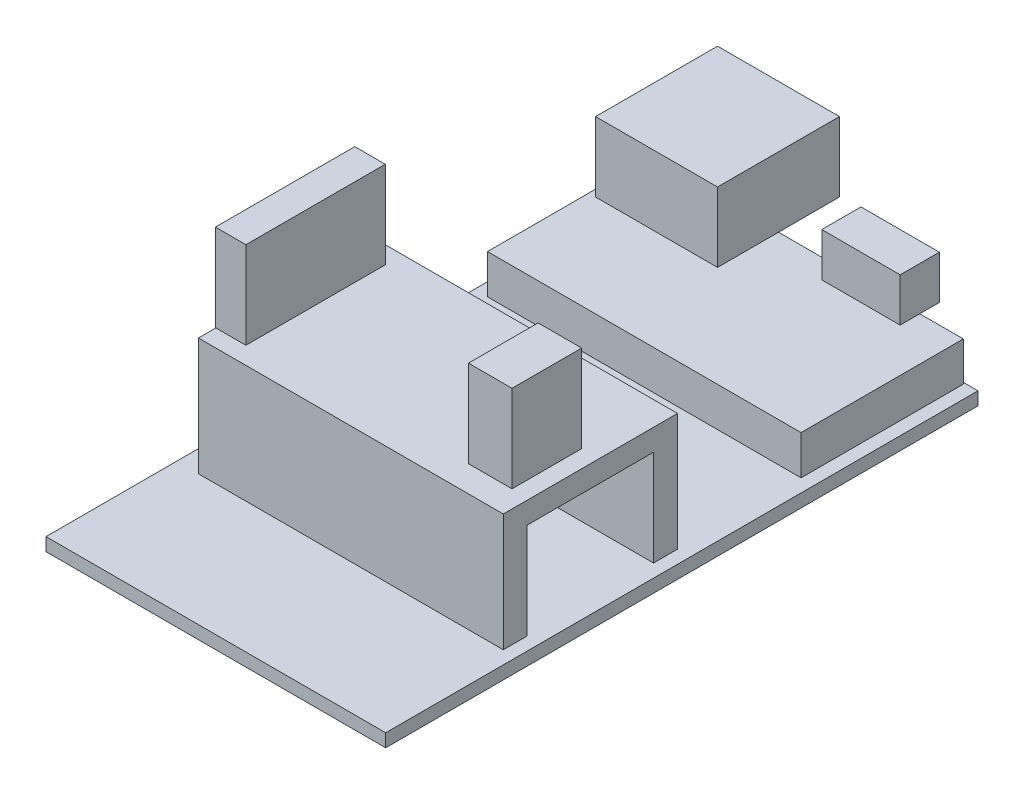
SolidWorks part; units mm, degrees
ref_plane "Front Plane" through (0, 0, 0) normal (0, 0, 1) x (1, 0, 0)
ref_plane "Top Plane" through (0, 0, 0) normal (0, 1, 0) x (1, 0, 0)
ref_plane "Right Plane" through (0, 0, 0) normal (1, 0, 0) x (0, 0, -1)
sketch "Sketch1" plane through (0, 0, 0) normal (0, 1, 0) x (1, 0, 0)
  line L1 (-19.5, 34) -> (19.5, 34)
  line L2 (-19.5, 34) -> (-19.5, -34)
  line L3 (-19.5, -34) -> (19.5, -34)
  line L4 (19.5, 34) -> (19.5, -34)
  line L5 (-19.5, 34) -> (19.5, -34) construction
  line L6 (-19.5, -34) -> (19.5, 34) construction
  point P0 (0, 0)
  dimension "D1" = 39
  dimension "D2" = 68
extrude "Boss-Extrude1" add sketch "Sketch1" along normal blind 1.5
sketch "Sketch2" plane through (0, 0, 0) normal (0, 1, 0) x (1, 0, 0)
  line L0 (0.5, -9) -> (0.5, -34) construction
  line L1 (-17, 1) -> (18, 1)
  line L2 (-17, 1) -> (-17, -19)
  line L3 (-17, -19) -> (18, -19)
  line L4 (18, 1) -> (18, -19)
  line L5 (-17, 1) -> (18, -19) construction
  line L6 (-17, -19) -> (18, 1) construction
  line L7 (-19.5, -34) -> (19.5, -34) construction
  line L8 (0.5, -9) -> (19.5, -9) construction
  line L9 (19.5, -34) -> (19.5, 34) construction
  point P0 (0.5, -9)
  dimension "D1" = 35
  dimension "D2" = 20
  dimension "D3" = 25
  dimension "D4" = 19
extrude "Boss-Extrude2" add sketch "Sketch2" along normal blind 15
sketch "Sketch3" plane through (0, 15, 0) normal (0, 1, 0) x (1, 0, 0)
  line L0 (18, 1) -> (18, -19) construction
  line L1 (-17.05, -1) -> (-13.55, -1)
  line L2 (-17.05, -1) -> (-17.05, -17)
  line L3 (-17.05, -17) -> (-13.55, -17)
  line L4 (-13.55, -1) -> (-13.55, -17)
  line L5 (-17.05, -1) -> (-13.55, -17) construction
  line L6 (-17.05, -17) -> (-13.55, -1) construction
  line L7 (16, -8) -> (11, -8)
  line L8 (16, -8) -> (16, -16)
  line L9 (16, -16) -> (11, -16)
  line L10 (11, -8) -> (11, -16)
  line L11 (16, -8) -> (11, -16) construction
  line L12 (16, -16) -> (11, -8) construction
  line L15 (-17, -19) -> (18, -19) construction
  line L16 (-17, 1) -> (-17, -19) construction
  line L17 (18, -19) -> (-17, -19) construction
  point P0 (-15.3, -9)
  point P5 (13.5, -12)
  point P12 (-17, -9)
  dimension "D1" = 8
  dimension "D2" = 5
  dimension "D3" = 4.5
  dimension "D4" = 7
  dimension "D5" = 16
  dimension "D6" = 3.5
  dimension "D7" = 1.7
  dimension "D8" = 10
extrude "Boss-Extrude3" add sketch "Sketch3" along normal blind 10
sketch "Sketch4" plane through (-17, 0, 0) normal (-1, 0, 0) x (0, 0, 1)
  line L0 (19, 1.5) -> (-1, 1.5) construction
  line L1 (1.7487, 12.5197) -> (16.2513, 12.5197)
  line L2 (1.7487, 12.5197) -> (1.7487, 1.5)
  line L3 (1.7487, 1.5) -> (16.2513, 1.5)
  line L4 (16.2513, 12.5197) -> (16.2513, 1.5)
  line L5 (1.7487, 12.5197) -> (16.2513, 1.5) construction
  line L6 (1.7487, 1.5) -> (16.2513, 12.5197) construction
  line L7 (-1, 15) -> (-1, 1.5) construction
  point P0 (9, 7.0098)
  dimension "D1" = 10
extrude "Cut-Extrude1" cut sketch "Sketch4" against normal blind 40
sketch "Sketch5" plane through (0, 0, 0) normal (0, 1, 0) x (1, 0, 0)
  line L0 (-19.5, 34) -> (-19.5, -34) construction
  line L1 (-18, 33.8121) -> (18, 33.8121)
  line L2 (-18, 33.8121) -> (-18, 15.1879)
  line L3 (-18, 15.1879) -> (18, 15.1879)
  line L4 (18, 33.8121) -> (18, 15.1879)
  line L5 (-18, 33.8121) -> (18, 15.1879) construction
  line L6 (-18, 15.1879) -> (18, 33.8121) construction
  line L7 (19.5, 34) -> (-19.5, 34) construction
  point P0 (0, 24.5)
  dimension "D1" = 36
  dimension "D2" = 19.5
  dimension "D3" = 9.5
extrude "Boss-Extrude4" add sketch "Sketch5" along normal blind 6
sketch "Sketch6" plane through (0, 6, 0) normal (0, 1, 0) x (1, 0, 0)
  line L0 (18, 33.8121) -> (-18, 33.8121) construction
  line L1 (-17.2174, 40.8121) -> (-3.2174, 40.8121)
  line L2 (-17.2174, 40.8121) -> (-17.2174, 26.8121)
  line L3 (-17.2174, 26.8121) -> (-3.2174, 26.8121)
  line L4 (-3.2174, 40.8121) -> (-3.2174, 26.8121)
  line L5 (-17.2174, 40.8121) -> (-3.2174, 26.8121) construction
  line L6 (-17.2174, 26.8121) -> (-3.2174, 40.8121) construction
  line L7 (-18, 33.8121) -> (18, 33.8121) construction
  line L8 (4, 36.0621) -> (13, 36.0621)
  line L9 (4, 36.0621) -> (4, 31.5621)
  line L10 (4, 31.5621) -> (13, 31.5621)
  line L11 (13, 36.0621) -> (13, 31.5621)
  line L12 (4, 36.0621) -> (13, 31.5621) construction
  line L13 (4, 31.5621) -> (13, 36.0621) construction
  line L14 (-19.5, 34) -> (-19.5, -34) construction
  line L15 (19.5, -34) -> (19.5, 34) construction
  point P0 (-10.2174, 33.8121)
  point P7 (8.5, 33.8121)
  dimension "D1" = 14
  dimension "D2" = 14
  dimension "D3" = 2.2826
  dimension "D4" = 22.7174
  dimension "D5" = 9
  dimension "D6" = 4.5
  dimension "D7" = 11
sketch "Sketch8" plane through (0, 6, 0) normal (0, 1, 0) x (1, 0, 0)
  line L1 (4, 36.0621) -> (13, 36.0621)
  line L2 (4, 36.0621) -> (4, 31.5621)
  line L3 (4, 31.5621) -> (13, 31.5621)
  line L4 (13, 36.0621) -> (13, 31.5621)
  line L5 (4, 36.0621) -> (13, 31.5621) construction
  line L6 (4, 31.5621) -> (13, 36.0621) construction
  point P1 (8.5, 33.8121)
extrude "Boss-Extrude7" add sketch "Sketch6" along normal blind 8 contours L4 L3 L2 L1
extrude "Boss-Extrude8" add sketch "Sketch8" along normal blind 5
